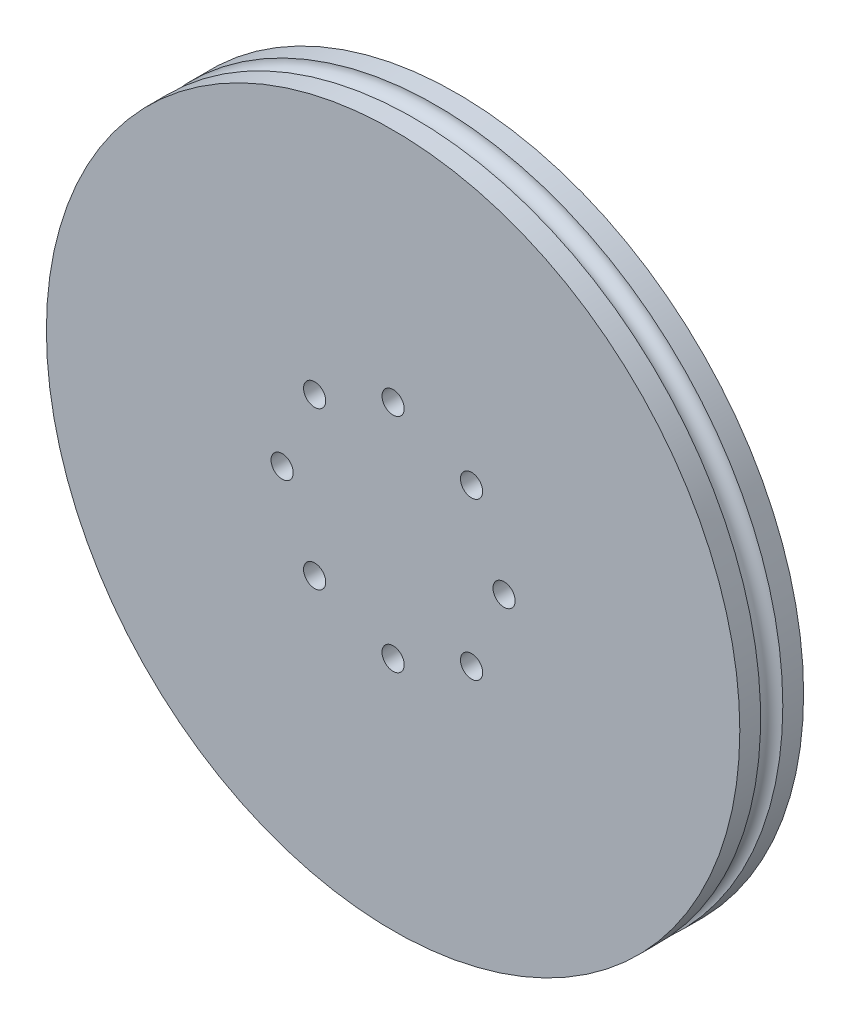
SolidWorks part; units mm, degrees
ref_plane "Plan de face" through (0, 0, 0) normal (0, 0, 1) x (1, 0, 0)
ref_plane "Plan de dessus" through (0, 0, 0) normal (0, 1, 0) x (1, 0, 0)
ref_plane "Plan de droite" through (0, 0, 0) normal (1, 0, 0) x (0, 0, -1)
sketch "Esquisse1" plane through (0, 0, 0) normal (0, 0, 1) x (1, 0, 0)
  circle A0 centre (0, 0) radius 125
  circle A1 centre (0, 0) radius 40 construction
  circle A2 centre (0, 40) radius 4
  circle A3 centre (28.2846, 28.285) radius 4
  circle A4 centre (40.001, 0.001) radius 4
  circle A5 centre (28.286, -28.2836) radius 4
  circle A6 centre (0.002, -40) radius 4
  circle A7 centre (-28.2826, -28.285) radius 4
  circle A8 centre (-39.999, -0.001) radius 4
  circle A9 centre (-28.284, 28.2836) radius 4
  dimension "D1" = 250
  dimension "D2" = 80
  dimension "D3" = 8
  dimension "D4" = 8
extrude "Boss.-Extru.1" add sketch "Esquisse1" along normal blind 23
sketch "Esquisse2" plane through (0, 0, 0) normal (0, 1, 0) x (1, 0, 0)
  line L0 (125, -23) -> (125, 0) construction
  line L1 (0, 0) -> (0, -23) construction
  line L2 (-125, -23) -> (125, -23) construction
  circle A0 centre (125, -11.5) radius 4
  dimension "D1" = 8
revolve "Enlèvement de matière-Révolution1" cut sketch "Esquisse2" angle 360 about L1
